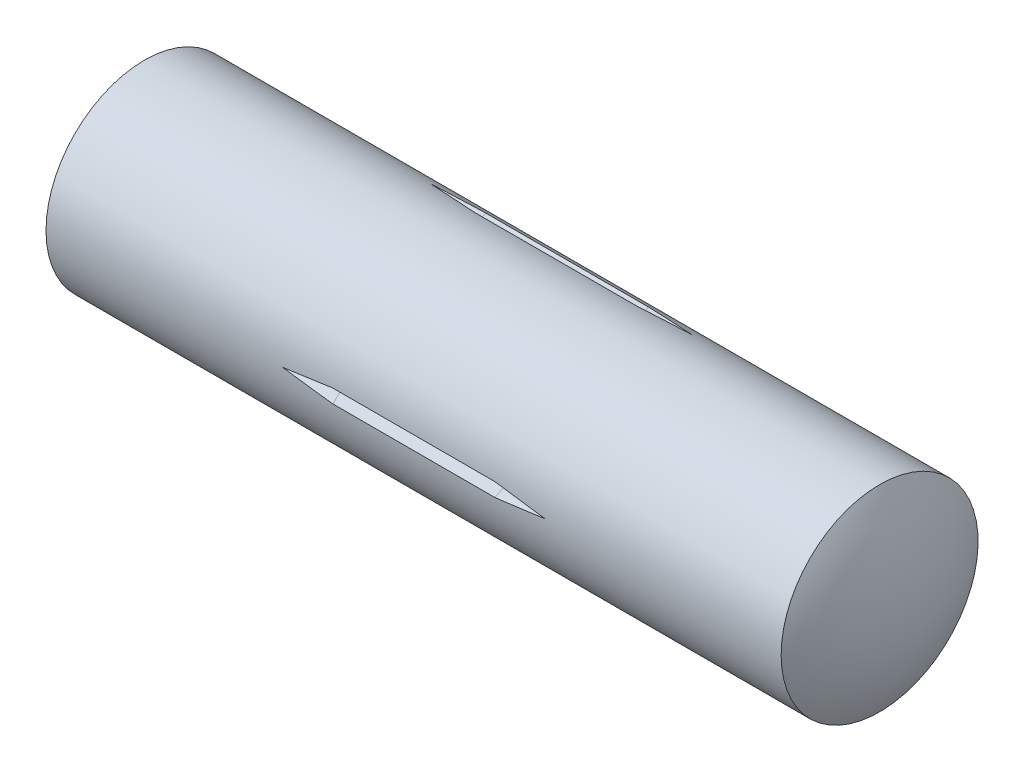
SolidWorks part; units mm, degrees
ref_plane "Plane1" through (0, 0, 0) normal (0, 0, 1) x (1, 0, 0)
ref_plane "Plane2" through (0, 0, 0) normal (0, 1, 0) x (1, 0, 0)
ref_plane "Plane3" through (0, 0, 0) normal (1, 0, 0) x (0, 0, -1)
sketch "Sketch1" plane through (0, 0, 0) normal (0, 0, 1) x (1, 0, 0)
  line L0 (-57, 0) -> (60, 0) construction
  line L1 (-50, 0) -> (-50, 1.25)
  line L2 (-46.6819, 12.5) -> (46.6506, 12.5)
  line L3 (-50, 0) -> (50, 0)
  arc A0 (-46.6819, 12.5) -> (-50, 1.25) centre (-25.0313, 0) ccw
  arc A1 (50, 0) -> (46.6506, 12.5) centre (25, 0) ccw
  dimension "D1" = 25
  dimension "D2" = 25
  dimension "Diameter" = 25
  dimension "D3" = 2.5
  dimension "Length" = 100
revolve "Base-Revolve" add sketch "Sketch1" angle 360 about L0
sketch "Sketch3" plane through (0, 0, 0) normal (0, 1, 0) x (1, 0, 0)
  line L0 (0, 0) -> (60, 0) construction
  line L1 (-57, 0) -> (60, 0) construction
  line L2 (-16.6667, -12.5) -> (-10.4167, -11.25)
  line L3 (-10.4167, -11.25) -> (10.4167, -11.25)
  line L4 (10.4167, -11.25) -> (16.6667, -12.5)
  dimension "D1" = 25
  dimension "D2" = 33.3333
  dimension "D3" = 16.6667
  dimension "D4" = 22.5
  dimension "D5" = 6.25
  dimension "D6" = 6.25
ref_plane "Plane4" through (-16.6667, 0, 0) normal (1, 0, 0) x (0, 0, -1)
sketch "Sketch4" plane through (-16.6667, 0, 0) normal (1, 0, 0) x (0, 0, -1)
  line L0 (0, 0) -> (-14, 0) construction
  line L1 (-12.5, 0) -> (-14.3784, 1.3152)
  line L2 (-12.5, 0) -> (-14.3784, -1.3152)
  line L3 (-14.3784, -1.3152) -> (-14.3784, 1.3152)
  circle A0 centre (0, 0) radius 12.5 construction
  dimension "D1" = 25
  dimension "D2" = 70
  dimension "D3" = 35
  dimension "D4" = 1.8784
sweep "Cut-Sweep3" cut profiles "Sketch4" path "Sketch3"
pattern_circular "CirPattern2" count 3 over 360 about axis through (0, 0, 0) along (1, 0, 0) of "Cut-Sweep3"
equation "\"D1@Sketch1\" = \"Diameter@Sketch1\""
equation "\"D2@Sketch1\" = \"Diameter@Sketch1\""
equation "\"D3@Sketch1\" = \"Diameter@Sketch1\" * .1"
equation "\"D1@Sketch3\" = \"Diameter@Sketch1\""
equation "\"D2@Sketch3\" = \"Length@Sketch1\" / 3"
equation "\"D3@Sketch3\" = \"D2@Sketch3\" / 2"
equation "\"D4@Sketch3\" = \"Diameter@Sketch1\" * .9"
equation "\"D5@Sketch3\" = \"D1@Sketch1\" / 4"
equation "\"D6@Sketch3\" = \"D5@Sketch3\""
equation "\"D1@Plane4\" = \"D3@Sketch3\""
equation "\"D1@Sketch4\" = \"Diameter@Sketch1\""
equation "\"D3@Sketch4\" = \"D2@Sketch4\" / 2"
